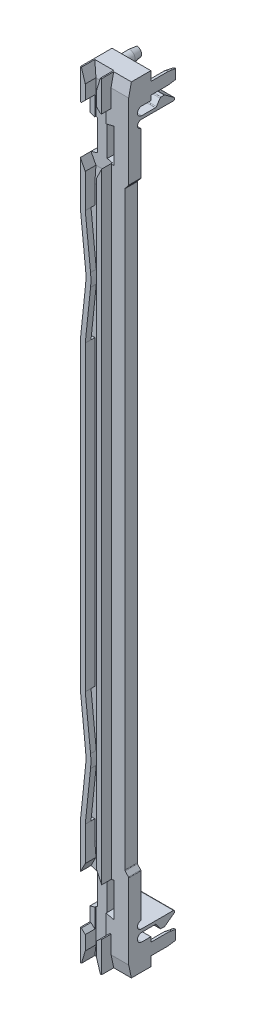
SolidWorks part; units mm, degrees
ref_plane "前视基准面" through (0, 0, 0) normal (0, 0, 1) x (1, 0, 0)
ref_plane "上视基准面" through (0, 0, 0) normal (0, 1, 0) x (1, 0, 0)
ref_plane "右视基准面" through (0, 0, 0) normal (1, 0, 0) x (0, 0, -1)
sketch "草图1" plane through (0, 0, 0) normal (0, 0, 1) x (1, 0, 0)
  line L0 (3.56, 89.5) -> (-6.6, 89.5) construction
  line L1 (-0.25, -0.4) -> (-0.25, 8.6)
  line L2 (-2.35, 170.9) -> (-2.35, 178.9)
  line L3 (3.56, 191) -> (3.56, 167.9)
  line L5 (-4.95, 170.9) -> (-4.95, 178.9)
  line L6 (-6.6, 191) -> (-6.6, 179.4)
  line L7 (2.6, 166.75) -> (3.56, 167.9)
  line L8 (-0.25, 170.4) -> (-2.35, 170.9)
  line L9 (-6.6, 170.4) -> (-4.95, 170.9)
  line L10 (-6.6, 179.4) -> (-4.95, 178.9)
  line L11 (-0.25, 179.4) -> (-2.35, 178.9)
  line L13 (-0.25, 179.4) -> (-0.25, 170.4)
  line L26 (3.56, -12) -> (-6.6, -12)
  line L27 (-0.25, -0.4) -> (-2.35, 0.1)
  line L28 (-6.6, -0.4) -> (-4.95, 0.1)
  line L29 (-6.6, 8.6) -> (-4.95, 8.1)
  line L30 (-0.25, 8.6) -> (-2.35, 8.1)
  line L31 (2.6, 12.25) -> (3.56, 11.1)
  line L32 (-6.6, -12) -> (-6.6, -0.4)
  line L33 (-6.6, 8.6) -> (-6.6, 170.4)
  line L34 (-4.95, 8.1) -> (-4.95, 0.1)
  line L35 (2.6, 166.75) -> (2.6, 12.25)
  line L38 (3.56, -12) -> (3.56, 11.1)
  line L39 (-2.35, 8.1) -> (-2.35, 0.1)
  line L40 (3.56, 191) -> (-6.6, 191)
  point P12 (2.6, 89.5)
  dimension "D2" = 2.1
  dimension "D3" = 10.16
  dimension "D4" = 23.1
  dimension "D5" = 203
  dimension "D6" = 9.2
  dimension "D7" = 154.5
  dimension "D8" = 11.6
  dimension "D9" = 9
  dimension "D10" = 8
  dimension "D11" = 6.35
  dimension "D12" = 8
  dimension "D13" = 2.6
  dimension "D14" = 23.1
extrude "凸台-拉伸1" add sketch "草图1" against normal blind 5.8
sketch "草图2" plane through (-6.6, 0, 0) normal (-1, 0, 0) x (0, 0, 1)
  line L1 (-5.8, 170.9) -> (-4.3, 170.9)
  line L2 (-5.8, 170.9) -> (-5.8, 8.1)
  line L3 (-5.8, 8.1) -> (-4.3, 8.1)
  line L4 (-4.3, 170.9) -> (-4.3, 8.1)
  line L6 (-5.8, 8.1) -> (0, 8.1) construction
  line L7 (-5.8, 178.9) -> (-5.8, 170.9) construction
  line L8 (-5.8, 170.9) -> (0, 170.9) construction
  dimension "D1" = 1.5
extrude "切除-拉伸1" cut sketch "草图2" against normal up to surface (1.65 mm away)
sketch "草图3" plane through (3.56, 365.7228, 0) normal (-1, 0, 0) x (0, 0, -1)
  line L0 (0, 276.2228) -> (5.8, 276.2228) construction
  line L1 (0, 353.4728) -> (0, 198.9728) construction
  line L2 (5.8, 353.4728) -> (5.8, 198.9728) construction
  line L3 (5.9, 186.5228) -> (3.3, 186.5228)
  line L5 (5.9, 184.5228) -> (3.3, 184.5228)
  line L6 (5.9, 186.5228) -> (5.9, 184.5228)
  line L7 (5.9, 183.5228) -> (2.3, 183.5228)
  line L8 (5.9, 181.5228) -> (2.3, 181.5228)
  line L9 (5.9, 183.5228) -> (5.9, 181.5228)
  line L10 (5.8, 174.7228) -> (0, 174.7228) construction
  line L12 (2.3, 366.9228) -> (2.3, -16.9352) construction
  line L13 (2.3, 368.9228) -> (2.3, 370.9228)
  line L14 (5.9, 368.9228) -> (5.9, 370.9228)
  line L15 (5.9, 370.9228) -> (2.3, 370.9228)
  line L19 (2.3, 183.5228) -> (2.3, 181.5228)
  line L21 (2.3, 185.5228) -> (2.3, 569.3808) construction
  line L22 (5.9, 368.9228) -> (2.3, 368.9228)
  line L23 (5.9, 365.9228) -> (5.9, 367.9228)
  line L24 (5.9, 367.9228) -> (3.3, 367.9228)
  line L25 (5.9, 365.9228) -> (3.3, 365.9228)
  arc A0 (3.3, 186.5228) -> (3.3, 184.5228) centre (3.3, 185.5228) ccw
  arc A1 (3.3, 365.9228) -> (3.3, 367.9228) centre (3.3, 366.9228) cw
  dimension "D3" = 2
  dimension "D4" = 1
  dimension "D5" = 3.6
  dimension "D7" = 3.6
  dimension "D1" = 6.8
  dimension "D2" = 2
  dimension "D6" = 2
  dimension "D8" = 1
extrude "切除-拉伸2" cut sketch "草图3" along normal blind 15
sketch "草图4" plane through (3.56, 365.7228, 0) normal (-1, 0, 0) x (0, 0, -1)
  line L0 (3.3, 184.5228) -> (5.8, 184.5228) construction
  line L1 (3.2, 184.5228) -> (5.8, 184.5228)
  line L2 (3.2, 184.5228) -> (3.2, 367.9228)
  line L3 (3.2, 367.9228) -> (5.8, 367.9228)
  line L4 (5.8, 184.5228) -> (5.8, 367.9228)
  line L5 (5.8, 184.5228) -> (5.8, 183.5228) construction
  line L7 (5.8, 367.9228) -> (3.3, 367.9228) construction
  dimension "D1" = 2.6
extrude "切除-拉伸3" cut sketch "草图4" along normal blind 15
sketch "草图5" plane through (0, 0, -5.8) normal (0, 0, -1) x (-1, 0, 0)
  line L0 (-3.56, 191) -> (6.6, 191) construction
  line L1 (-2.6, 89.5) -> (6.6, 89.5) construction
  line L4 (-3.56, 188.55) -> (-3.56, 185.45)
  line L5 (-3.56, 191) -> (6.6, 191) construction
  line L6 (6.6, 188.55) -> (6.6, 185.45)
  line L8 (6.6, -9.55) -> (6.6, -6.45)
  line L9 (-3.56, -9.55) -> (-3.56, -6.45)
  line L10 (-3.56, 167.9) -> (-3.56, 191) construction
  line L13 (6.6, 191) -> (6.6, 184.2) construction
  line L14 (6.6, -5.2) -> (6.6, -12) construction
  circle A0 centre (1.52, 187) radius 1.55
  arc A1 (6.6, 188.55) -> (6.6, 185.45) centre (6.6, 187) ccw
  arc A2 (-3.56, 185.45) -> (-3.56, 188.55) centre (-3.56, 187) ccw
  arc A3 (-3.56, -6.45) -> (-3.56, -9.55) centre (-3.56, -8) cw
  arc A4 (6.6, -9.55) -> (6.6, -6.45) centre (6.6, -8) cw
  circle A5 centre (1.52, -8) radius 1.55
  point P2 (1.52, 191)
  dimension "D1" = 0
  dimension "D2" = 97.5
  dimension "D3" = 3.1
  dimension "D4" = 0
  dimension "D5" = 0
  dimension "D6" = 5.08
  dimension "D7" = 5.08
  dimension "D8" = 1.55
  dimension "D9" = 1.55
  dimension "D10" = 101.5
extrude "凸台-拉伸2" add sketch "草图5" along normal blind 6.5
chamfer "倒角1" distance 2 distance2 0.3 4 edges at (-5.05, -8, -12.3) (2.01, -8, -12.3) (-5.05, 187, -12.3) (2.01, 187, -12.3)
sketch "草图6" plane through (0, 0, -12.3) normal (0, 0, -1) x (-1, 0, 0)
  circle A0 centre (1.52, 187) radius 1.55
  circle A1 centre (1.52, -8) radius 1.55
  dimension "D1" = 3.1
  dimension "D2" = 3.1
extrude "切除-拉伸4" cut sketch "草图6" against normal blind 4.5
sketch "草图7" plane through (0, 0, -7.8) normal (0, 0, -1) x (-1, 0, 0)
  circle A0 centre (1.52, 187) radius 1
  circle A1 centre (1.52, -8) radius 1
  dimension "D1" = 2
  dimension "D2" = 2
extrude "切除-拉伸5" cut sketch "草图7" against normal up to surface (2 mm away)
fillet "圆角1" radius 0.3 6 edges at (-3.07, -8, -7.8) (-3.07, 187, -7.8) (2.6, 12.25, -1.6) (3.56, 11.1, -1.6) (2.6, 166.75, -1.6) (3.56, 167.9, -1.6)
sketch "草图8" plane through (3.56, 0, 0) normal (-1, 0, 0) x (0, 0, 1)
  line L0 (-5.8, 182.2) -> (-7.3, 182.2)
  line L1 (-12, 181.2) -> (-5.8, 181.2)
  line L2 (-5.8, 182.2) -> (-5.8, 181.2)
  line L3 (-7.3, 182.2) -> (-8.3, 183.7)
  line L4 (-12, 181.2) -> (-12, 181.8)
  line L5 (-12, 181.8) -> (-9.4, 183.7)
  line L6 (-3.2, 89.5) -> (0, 89.5) construction
  line L7 (-3.2, 181.2) -> (-5.8, 181.2) construction
  line L8 (0, 170.4) -> (0, 8.6) construction
  line L9 (-3.2, 170.4) -> (-3.2, 8.6) construction
  line L10 (-7.3, -3.2) -> (-8.3, -4.7)
  line L12 (-9.4, -4.7) -> (-8.3, -4.7)
  line L13 (-12, -2.8) -> (-9.4, -4.7)
  line L14 (-12, -2.2) -> (-12, -2.8)
  line L15 (0, 191) -> (0, 179.4) construction
  line L16 (-9.4, 183.7) -> (-8.3, 183.7)
  line L17 (-5.8, 185.45) -> (-5.8, 184.2) construction
  line L18 (-5.8, 182.2) -> (-2.3, 182.2) construction
  line L19 (-5.8, 184.2) -> (-5.8, 185.45) construction
  line L20 (-5.8, -3.2) -> (-5.8, -2.2)
  line L21 (-12, -2.2) -> (-5.8, -2.2)
  line L22 (-5.8, -3.2) -> (-7.3, -3.2)
  dimension "D3" = 2.6
  dimension "D6" = 3.7
  dimension "D1" = 12
  dimension "D2" = 0.6
  dimension "D4" = 1.5
  dimension "D5" = 2.5
extrude "凸台-拉伸3" add sketch "草图8" along normal up to surface (10.16 mm away)
sketch "草图9" plane through (0, 0, 0) normal (0, 0, 1) x (1, 0, 0)
  line L0 (-6.6, 191) -> (-6.3, 191)
  line L1 (3.56, 191) -> (-6.6, 191) construction
  line L2 (-6.6, 191) -> (-6.6, 183)
  line L3 (-6.6, 191) -> (-6.6, 179.4) construction
  line L4 (-6.6, 183) -> (-6.3, 183)
  line L5 (-5.3, 184) -> (-5.3, 187.7)
  line L6 (-6.3, 191) -> (-5.3, 187.7)
  line L7 (-2.3, 167.9) -> (-1, 170.5786)
  line L8 (-1.35, 191) -> (-2.35, 187.7)
  line L9 (-2.35, 184) -> (-2.35, 187.7)
  line L10 (-6.3, 183) -> (-5.3, 184)
  line L11 (-1.05, 191) -> (-1.05, 183)
  line L12 (-5.3, 167.9) -> (-6.6, 170.4)
  line L13 (-2.35, 170.9) -> (-0.25, 170.4) construction
  line L14 (-2.3, 11.1) -> (-1, 8.4214)
  line L15 (-6.6, 170.4) -> (-6.6, 8.6) construction
  line L17 (-2.35, 178.9) -> (-2.35, 170.9) construction
  line L19 (-6.6, 89.5) -> (2.6, 89.5) construction
  line L20 (2.6, 12.3588) -> (2.6, 166.6412) construction
  line L23 (-5.3, 11.1) -> (-6.6, 8.6)
  line L24 (-0.25, 8.6) -> (-2.35, 8.1) construction
  line L25 (-1.05, 191) -> (-1.35, 191)
  line L26 (-1.35, -4) -> (-2.35, -5)
  line L27 (-1.05, -4) -> (-1.35, -4)
  line L28 (-1.05, -12) -> (-1.35, -12)
  line L29 (-1.05, -12) -> (-1.05, -4)
  line L30 (-6.3, -4) -> (-5.3, -5)
  line L31 (-2.35, -5) -> (-2.35, -8.7)
  line L32 (-1.35, -12) -> (-2.35, -8.7)
  line L33 (-6.3, -12) -> (-5.3, -8.7)
  line L34 (-5.3, -5) -> (-5.3, -8.7)
  line L35 (-5.3, 11.1) -> (-5.3, 167.9)
  line L36 (-2.3, 167.9) -> (-2.3, 11.1)
  line L37 (-1, 8.4214) -> (-1, 170.5786)
  line L38 (-6.6, 8.6) -> (-6.6, 170.4)
  line L39 (-11.8081, 151) -> (4.8238, 151) construction
  line L40 (3.56, 191) -> (-6.6, 191) construction
  line L41 (-6.6, -4) -> (-6.3, -4)
  line L42 (-6.6, -12) -> (-6.6, -4)
  line L43 (3.56, 191) -> (-6.6, 191) construction
  line L44 (-6.6, 170.4) -> (-6.6, 8.6) construction
  line L45 (-1.05, 183) -> (-1.35, 183)
  line L46 (-1.35, 183) -> (-2.35, 184)
  line L47 (-6.6, -12) -> (-6.3, -12)
  dimension "D1" = 0.3
  dimension "D2" = 8
  dimension "D3" = 1.3
  dimension "D4" = 1
  dimension "D5" = 3.3
  dimension "D6" = 1.3
  dimension "D7" = 1.3
  dimension "D8" = 3
  dimension "D10" = 2.5
  dimension "D12" = 1.3
  dimension "D16" = 40
  dimension "D18" = 3.3
  dimension "D19" = 1
  dimension "D20" = 1
  dimension "D21" = 1
  dimension "D22" = 8
  dimension "D23" = 0.3
extrude "凸台-拉伸5" add sketch "草图9" along normal blind 2.5
sketch "草图10" plane through (0, 0, 2.5) normal (0, 0, 1) x (1, 0, 0)
  line L0 (-6.6, 170.4) -> (-6.6, 8.6) construction
  line L2 (-6.3, -12) -> (-1.35, -12) construction
  line L3 (-6.6, 159) -> (-5.3, 159)
  line L4 (-6.6, 159) -> (-6.6, 129)
  line L5 (-6.6, 129) -> (-5.3, 129)
  line L6 (-5.3, 159) -> (-5.3, 129)
  line L10 (-5.3, 20) -> (-5.3, 50)
  line L11 (-6.6, 50) -> (-5.3, 50)
  line L12 (-6.6, 20) -> (-6.6, 50)
  line L13 (-6.6, 20) -> (-5.3, 20)
  line L14 (3.56, 191) -> (-1.05, 191) construction
  dimension "D1" = 1.3
  dimension "D2" = 30
  dimension "D3" = 32
  dimension "D4" = 32
  dimension "D5" = 30
  dimension "D6" = 1.3
extrude "切除-拉伸6" cut sketch "草图10" against normal up to surface (2.5 mm away)
sketch "草图11" plane through (0, 0, 2.5) normal (0, 0, 1) x (1, 0, 0)
  line L1 (-6.6, 159) -> (-5.2, 145.5533)
  line L2 (-5.2, 142.4467) -> (-6.6, 129)
  line L3 (-5.3, 159) -> (-3.9139, 145.6872)
  line L4 (-6.6, 159) -> (-5.3, 159)
  line L5 (-3.9139, 142.3128) -> (-5.3, 129)
  line L6 (-6.6, 129) -> (-5.3, 129)
  line L7 (-6.6, 50) -> (-5.3, 50)
  line L8 (-3.9139, 142.3128) -> (-5.3139, 128.8661) construction
  line L9 (-6.6, 89.5) -> (-1, 89.5) construction
  line L10 (-6.6, 129) -> (-6.6, 50) construction
  line L11 (-5.3139, 159.1339) -> (-3.9139, 145.6872) construction
  line L12 (-6.6, 129) -> (-6.6, 159) construction
  line L13 (-3.9139, 36.6872) -> (-5.3, 50)
  line L14 (-6.6, 20) -> (-5.3, 20)
  line L15 (-5.3, 20) -> (-3.9139, 33.3128)
  line L16 (-5.2, 36.5533) -> (-6.6, 50)
  line L17 (-6.6, 20) -> (-5.2, 33.4467)
  arc A0 (-5.2, 145.5533) -> (-5.2, 142.4467) centre (-20.1194, 144) cw
  arc A1 (-3.9139, 145.6872) -> (-3.9139, 142.3128) centre (-20.1194, 144) cw
  arc A2 (-3.9139, 33.3128) -> (-3.9139, 36.6872) centre (-20.1194, 35) ccw
  arc A3 (-5.2, 33.4467) -> (-5.2, 36.5533) centre (-20.1194, 35) ccw
  point P10 (-5.0383, 144)
  point P19 (-5.0383, 35)
  dimension "D3" = 15
  dimension "D2" = 1.4
  dimension "D1" = 15
extrude "凸台-拉伸6" add sketch "草图11" against normal blind 1.5
sketch "草图12" plane through (-4.95, 0, 0) normal (-1, 0, 0) x (0, 0, 1)
  line L0 (-3.2, 8.1) -> (-3.2, 0.1) construction
  line L1 (-3.2, 179.2) -> (-5.2, 179.2)
  line L2 (-3.2, 179.2) -> (-3.2, -0.2)
  line L3 (-3.2, -0.2) -> (-5.2, -0.2)
  line L4 (-5.2, 179.2) -> (-5.2, -0.2)
  line L5 (0, 8.1) -> (0, 0.1) construction
  line L7 (-5.8, -2.2) -> (-12, -2.2) construction
  line L8 (-12, 181.2) -> (-3.2, 181.2) construction
  dimension "D1" = 5.2
  dimension "D2" = 2
  dimension "D3" = 2
extrude "凸台-拉伸7" add sketch "草图12" against normal up to surface (2.6 mm away)
fillet "圆角2" radius 2 1 edges at (-6.6, 89.5, -3.2)
fillet "圆角4" radius 0.2 8 edges at (-3.65, -0.2, -5.2) (-2.35, 89.5, -5.2) (-3.65, 179.2, -5.2) (-4.95, 89.5, -5.2) (-2.35, 179.2, -4.2) (-4.95, 179.2, -4.2) (-4.95, -0.2, -4.2) (-2.35, -0.2, -4.2)
sketch "草图19" plane through (-6.6, 0, 0) normal (-1, 0, 0) x (0, 0, 1)
  line L0 (-7.3, 182.2) -> (-7.1667, 182)
  line L1 (-2.3, 182.2) -> (-7.3, 182.2)
  line L2 (-2.3, 182.2) -> (-2.3, 182)
  line L3 (-2.3, 182) -> (-7.1667, 182)
  line L4 (-7.3, 182.2) -> (-8.3, 183.7) construction
  line L5 (-2.3, -3.2) -> (-7.3, -3.2)
  line L6 (-2.3, -3.2) -> (-2.3, -3)
  line L7 (-2.3, -3) -> (-7.1667, -3)
  line L8 (-7.3, -3.2) -> (-7.1667, -3)
  line L10 (-8.3, -4.7) -> (-7.3, -3.2) construction
  dimension "D1" = 0.2
  dimension "D2" = 0.2
extrude "切除-拉伸11" cut sketch "草图19" against normal up to surface (10.16 mm away)
fillet "圆角5" radius 1.1 4 edges at (-1.52, -5.2, -2.3) (-1.52, 184.2, -2.3) (-1.52, 182, -2.3) (-1.52, -3, -2.3)
sketch "草图18" plane through (0, 0, -5.8) normal (0, 0, -1) x (-1, 0, 0)
  line L1 (0.44, 190.4) -> (6.6, 190.4)
  line L2 (0.44, 190.4) -> (0.44, 188.8)
  line L3 (0.44, 188.8) -> (6.6, 188.8)
  line L4 (6.6, 190.4) -> (6.6, 188.8)
  line L5 (-3.56, 191) -> (6.6, 191) construction
  line L7 (6.6, 89.5) -> (-2.6, 89.5) construction
  line L8 (6.6, 170.4) -> (6.6, 8.6) construction
  line L9 (-2.6, 166.6412) -> (-2.6, 12.3588) construction
  line L10 (6.6, -11.4) -> (6.6, -9.8)
  line L11 (0.44, -9.8) -> (6.6, -9.8)
  line L12 (0.44, -11.4) -> (0.44, -9.8)
  line L13 (0.44, -11.4) -> (6.6, -11.4)
  line L14 (-3.56, 188.55) -> (-3.56, 191) construction
  dimension "D1" = 1.6
  dimension "D2" = 2.2
  dimension "D3" = 4
  dimension "D4" = 1.6
extrude "切除-拉伸10" cut sketch "草图18" against normal blind 0.75
fillet "圆角6" radius 0.8 4 edges at (-3.52, 188.8, -5.05) (-3.52, 190.4, -5.05) (-3.52, -9.8, -5.05) (-3.52, -11.4, -5.05)
sketch "草图20" plane through (0, 0, -3.2) normal (0, 0, -1) x (-1, 0, 0)
  line L0 (-2.56, 179.205) -> (-2.56, 169.205) construction
  line L1 (-3.56, 179.205) -> (0.25, 179.205) construction
  line L2 (-3.56, 168.0088) -> (-3.56, 179.205) construction
  text T0 "RDEKONO" font "黑体" height 1.5
  dimension "D1" = 1
  dimension "D2" = 10
extrude "切除-拉伸12" cut sketch "草图20" against normal blind 0.2
fillet "圆角7" radius 0.3 10 edges at (-1.52, 181.2, -12) (-1.52, 181.8, -12) (-1.52, 183.7, -9.4) (-1.52, 183.7, -8.3) (-1.52, 182, -7.1667) (-1.52, -3, -7.1667) (-1.52, -4.7, -8.3) (-1.52, -4.7, -9.4) (-1.52, -2.2, -12) (-1.52, -2.8, -12)
ref_plane "基准面1" through (0, 178.9, 0) normal (0, 1, 0) x (1, 0, 0)
sketch "草图21" plane through (0, 178.9, 0) normal (0, 1, 0) x (1, 0, 0)
  line L0 (-4.95, 2.4) -> (-4.95, 3.7)
  line L1 (-5.45, 3.7) -> (-4.95, 2.4)
  line L2 (-4.95, 3.7) -> (-5.45, 3.7)
  line L3 (-4.95, 3.2) -> (-4.95, 0) construction
  dimension "D1" = 0.5
  dimension "D2" = 1.3
  dimension "D3" = 3.7
extrude "凸台-拉伸8" add sketch "草图21" against normal up to vertex
sketch "草图22" plane through (0, 0, -3.7) normal (0, 0, -1) x (-1, 0, 0)
  line L0 (4.95, 170.9) -> (4.95, 178.9) construction
  line L1 (6.0789, 177.4) -> (4.95, 177.4)
  line L2 (6.0789, 177.4) -> (6.0789, 172.4)
  line L3 (6.0789, 172.4) -> (4.95, 172.4)
  line L4 (4.95, 177.4) -> (4.95, 172.4)
  line L5 (6.0789, 174.9) -> (4.95, 174.9) construction
  dimension "D1" = 2.5
  dimension "D2" = 4
extrude "切除-拉伸13" cut sketch "草图22" against normal blind 10
ref_plane "基准面2" through (-3.65, 0, 0) normal (-1, 0, 0) x (0, 0, 1)
mirror "镜向1" about plane through (-3.65, 0, 0) normal (-1, 0, 0) of "切除-拉伸13", "凸台-拉伸8"
ref_plane "基准面3" through (0, 89.5, 0) normal (0, -1, 0) x (-1, 0, 0)
mirror "镜向2" about plane through (0, 89.5, 0) normal (0, -1, 0) of "镜向1", "切除-拉伸13", "凸台-拉伸8"
fillet "圆角8" radius 0.1 8 edges at (-1.85, 7.35, -3.7) (-1.85, 0.85, -3.7) (-5.45, 0.85, -3.7) (-5.45, 7.35, -3.7) (-1.85, 171.65, -3.7) (-1.85, 178.15, -3.7) (-5.45, 171.65, -3.7) (-5.45, 178.15, -3.7)
sketch "草图24" plane through (0, 0, 0) normal (0, 0, 1) x (1, 0, 0)
  line L0 (-6.3, -12) -> (-5.3, -8.7)
  line L1 (-5.3, -8.7) -> (-5.3, 8.2061)
  line L2 (-5.3, 11.1) -> (-5.3, 20) construction
  line L3 (-5.3, 15.1) -> (-2.3, 15.1)
  line L4 (-2.3, 167.9) -> (-2.3, 11.1) construction
  line L5 (-6.3, -12) -> (-1.35, -12)
  line L6 (-1.35, -12) -> (-2.35, -8.7)
  line L7 (-2.35, -8.7) -> (-2.35, 8.1)
  line L8 (-2.35, 8.1) -> (-1, 8.4214)
  line L9 (-0.25, 8.6) -> (-1, 8.4214) construction
  line L10 (-1, 8.4214) -> (-2.3, 11.1)
  line L11 (-2.3, 11.1) -> (-2.3, 15.1)
  line L12 (-5.3, 8.2061) -> (-6.6, 8.6)
  line L13 (-6.6, 8.6) -> (-5.3, 11.1)
  line L14 (-5.3, 11.1) -> (-5.3, 15.1)
  line L16 (-6.6, 8.6) -> (-4.95, 8.1) construction
  line L17 (2.6, 89.5) -> (-6.6, 89.5) construction
  line L18 (2.6, 12.3588) -> (2.6, 166.6412) construction
  line L19 (-6.6, 129) -> (-6.6, 50) construction
  line L20 (-5.3, 167.9) -> (-5.3, 163.9)
  line L21 (-6.6, 170.4) -> (-5.3, 167.9)
  line L22 (-5.3, 170.7939) -> (-6.6, 170.4)
  line L23 (-2.3, 167.9) -> (-2.3, 163.9)
  line L24 (-1, 170.5786) -> (-2.3, 167.9)
  line L25 (-2.35, 170.9) -> (-1, 170.5786)
  line L26 (-2.35, 187.7) -> (-2.35, 170.9)
  line L27 (-1.35, 191) -> (-2.35, 187.7)
  line L28 (-6.3, 191) -> (-1.35, 191)
  line L29 (-5.3, 163.9) -> (-2.3, 163.9)
  line L30 (-5.3, 187.7) -> (-5.3, 170.7939)
  line L31 (-6.3, 191) -> (-5.3, 187.7)
  line L32 (-2.3, 11.1) -> (-1, 8.4214) construction
  dimension "D1" = 4
extrude "切除-拉伸14" cut sketch "草图24" against normal blind 0.3
chamfer "倒角2" distance 0.7 distance2 3.3 2 edges at (-3.825, -12, -0.3) (-3.825, 191, -0.3)
chamfer "倒角3" distance 0.7 distance2 3.3 2 edges at (1.255, -12, 0)
sketch "草图25" plane through (-5.3, 0, 0) normal (1, 0, 0) x (0, 0, -1)
  line L0 (0, 163.9) -> (0.3, 163.9)
  line L1 (0.3, 163.9) -> (0.3, 167.9)
  line L2 (0.3, 167.9) -> (0, 163.9)
  line L3 (0, 15.1) -> (0.3, 15.1)
  line L4 (0.3, 15.1) -> (0.3, 11.1)
  line L5 (0.3, 11.1) -> (0, 15.1)
extrude "凸台-拉伸9" add sketch "草图25" along normal up to surface (3 mm away)
